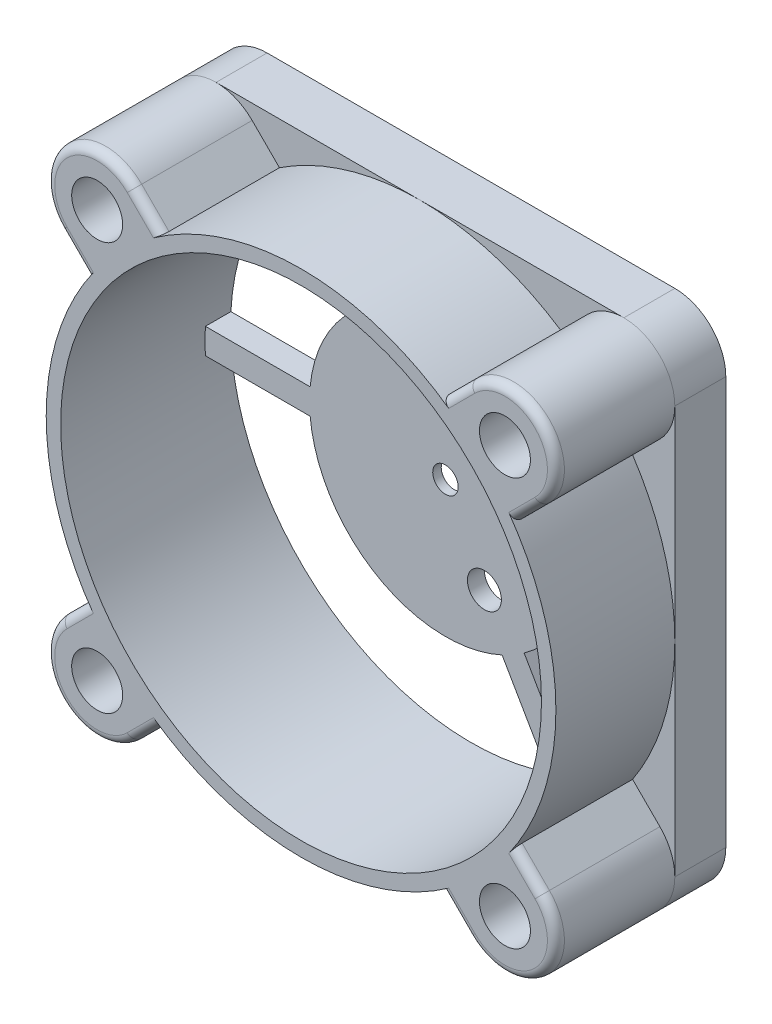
SolidWorks part; units mm, degrees
ref_plane "Front Plane" through (0, 0, 0) normal (0, 0, 1) x (1, 0, 0)
ref_plane "Top Plane" through (0, 0, 0) normal (0, 1, 0) x (1, 0, 0)
ref_plane "Right Plane" through (0, 0, 0) normal (1, 0, 0) x (0, 0, -1)
sketch "Sketch1" plane through (0, 0, 0) normal (0, 0, 1) x (1, 0, 0)
  line L1 (-15, 15) -> (15, 15)
  line L2 (-15, 15) -> (-15, -15)
  line L3 (-15, -15) -> (15, -15)
  line L4 (15, 15) -> (15, -15)
  line L5 (-15, 15) -> (15, -15) construction
  line L6 (-15, -15) -> (15, 15) construction
  point P0 (0, 0)
  dimension "D1" = 30
  dimension "D2" = 30
extrude "Boss-Extrude1" add sketch "Sketch1" along normal blind 3
sketch "Sketch2" plane through (0, 0, 3) normal (0, 0, 1) x (1, 0, 0)
  circle A0 centre (0, 0) radius 15
  dimension "D1" = 30
extrude "Boss-Extrude2" add sketch "Sketch2" along normal blind 7
sketch "Sketch4" plane through (0, 0, 3) normal (0, 0, 1) x (1, 0, 0)
  line L0 (-14.1213, 9.8787) -> (-4.2426, 0)
  line L1 (-9.8787, 14.1213) -> (0, 4.2426)
  line L2 (9.8787, 14.1213) -> (0, 4.2426)
  line L3 (14.1213, 9.8787) -> (4.2426, 0)
  line L4 (-4.2426, 0) -> (-14.1213, -9.8787)
  line L5 (0, -4.2426) -> (-9.8787, -14.1213)
  line L6 (4.2426, 0) -> (14.1213, -9.8787)
  line L7 (0, -4.2426) -> (9.8787, -14.1213)
  arc A0 (14.1213, 9.8787) -> (9.8787, 14.1213) centre (12, 12) ccw
  arc A1 (-9.8787, 14.1213) -> (-14.1213, 9.8787) centre (-12, 12) ccw
  arc A2 (-14.1213, -9.8787) -> (-9.8787, -14.1213) centre (-12, -12) ccw
  arc A3 (9.8787, -14.1213) -> (14.1213, -9.8787) centre (12, -12) ccw
  dimension "D8" = 6
  dimension "D9" = 6
  dimension "D10" = 6
  dimension "D11" = 6
  dimension "D1" = 24
  dimension "D2" = 24
  dimension "D3" = 24
  dimension "D4" = 24
  dimension "D5" = 12
  dimension "D6" = 12
  dimension "D7" = 12
extrude "Boss-Extrude3" add sketch "Sketch4" along normal blind 7
fillet "Fillet1" radius 3 4 edges at (-15, -15, 1.5) (15, -15, 1.5) (15, 15, 1.5) (-15, 15, 1.5)
sketch "Sketch5" plane through (0, 0, 10) normal (0, 0, 1) x (1, 0, 0)
  circle A0 centre (0, 0) radius 14.15
  dimension "D1" = 28.3
extrude "Cut-Extrude2" cut sketch "Sketch5" against normal blind 10
sketch "Sketch6" plane through (0, 0, 10) normal (0, 0, 1) x (1, 0, 0)
  circle A0 centre (-12, 12) radius 1.5
  circle A1 centre (12, 12) radius 1.5
  circle A2 centre (12, -12) radius 1.5
  circle A3 centre (-12, -12) radius 1.5
  dimension "D1" = 3
  dimension "D2" = 3
  dimension "D3" = 3
  dimension "D4" = 3
extrude "Cut-Extrude3" cut sketch "Sketch6" against normal blind 10
sketch "Sketch7" plane through (0, 0, 0) normal (0, 0, -1) x (-1, 0, 0)
  circle A0 centre (0, 0) radius 8
  dimension "D1" = 16
extrude "Boss-Extrude4" add sketch "Sketch7" against normal blind 1.5 separate body
sketch "Sketch8" plane through (0, 0, 0) normal (0, 0, -1) x (-1, 0, 0)
  line L0 (-0.0611, -1.6058) -> (-6.6399, -13.0006)
  line L1 (1.4212, 0.75) -> (14.5788, 0.75)
  line L2 (1.4212, 0.75) -> (1.4212, -0.75)
  line L3 (1.4212, -0.75) -> (14.5788, -0.75)
  line L4 (14.5788, 0.75) -> (14.5788, -0.75)
  line L5 (1.4212, 0.75) -> (14.5788, -0.75) construction
  line L6 (1.4212, -0.75) -> (14.5788, 0.75) construction
  line L7 (-1.3601, -0.8558) -> (-7.9389, -12.2506)
  line L8 (-6.6399, -13.0006) -> (-7.9389, -12.2506)
  line L9 (-0.0611, -1.6058) -> (-1.3601, -0.8558)
  line L10 (-1.3601, 0.8558) -> (-7.9389, 12.2506)
  line L11 (-0.0611, 1.6058) -> (-6.6399, 13.0006)
  line L12 (-7.9389, 12.2506) -> (-6.6399, 13.0006)
  line L13 (-1.3601, 0.8558) -> (-0.0611, 1.6058)
  circle A0 centre (0, 0) radius 8 construction
  point P0 (8, 0)
  point P18 (0, 0)
  dimension "D1" = 1.5
  dimension "D2" = 3
extrude "Boss-Extrude5" add sketch "Sketch8" against normal blind 1.5
sketch "Sketch9" plane through (0, 0, 0) normal (0, 0, -1) x (-1, 0, 0)
  circle A0 centre (0, 0) radius 0.75
  dimension "D1" = 1.5
extrude "Cut-Extrude4" cut sketch "Sketch9" against normal blind 1.5
sketch "Sketch10" plane through (0, 0, 0) normal (0, 0, -1) x (-1, 0, 0)
  circle A0 centre (0, 0) radius 2
  dimension "D1" = 4
extrude "Cut-Extrude5" cut sketch "Sketch10" against normal blind 1
sketch "Sketch11" plane through (0, 0, 0) normal (0, 0, -1) x (-1, 0, 0)
  circle A0 centre (0, 0) radius 6.75
  dimension "D1" = 13.5
extrude "Cut-Extrude6" cut sketch "Sketch11" against normal blind 0.5
sketch "Sketch12" plane through (0, 0, 0) normal (0, 0, -1) x (-1, 0, 0)
  line L0 (-15, -12) -> (-15, 12) construction
  line L1 (-6.4, -15.5013) -> (-9.8, -15.5013)
  line L2 (-6.4, -15.5013) -> (-6.4, -13.0013)
  line L3 (-6.4, -13.0013) -> (-9.8, -13.0013)
  line L4 (-9.8, -15.5013) -> (-9.8, -13.0013)
  dimension "D1" = 5.2
  dimension "D2" = 3.4
  dimension "D3" = 2.5
extrude "Cut-Extrude7" cut sketch "Sketch12" against normal blind 0.5
sketch "Sketch13" plane through (0, 0, 0) normal (0, 0, -1) x (-1, 0, 0)
  line L0 (-1.7991, -4.7161) -> (-6.993, -13.7123)
  line L1 (-6.993, -13.7123) -> (-7.6859, -13.3123)
  line L2 (-7.6859, -13.3123) -> (-2.4919, -4.3161)
  line L3 (-2.4919, -4.3161) -> (-1.7991, -4.7161)
  dimension "D1" = 0.8
  dimension "D2" = 0.75
  dimension "D3" = 0.75
extrude "Cut-Extrude8" cut sketch "Sketch13" against normal blind 0.5
sketch "Sketch14" plane through (0, 0, 0.5) normal (0, 0, -1) x (-1, 0, 0)
  circle A0 centre (-2.2919, -4.4829) radius 1
  dimension "D1" = 2
extrude "Cut-Extrude9" cut sketch "Sketch14" against normal blind 2
fillet "Fillet2" radius 0.5 12 edges at (-13.3175, -9.0748, 10) (-9.0748, -13.3175, 10) (9.0748, -13.3175, 10) (13.3175, -9.0748, 10) (13.3175, 9.0748, 10) (9.0748, 13.3175, 10) (-9.0748, 13.3175, 10) (-13.3175, 9.0748, 10) (-14.1213, -14.1213, 10) (14.1213, -14.1213, 10) (14.1213, 14.1213, 10) (-14.1213, 14.1213, 10)
